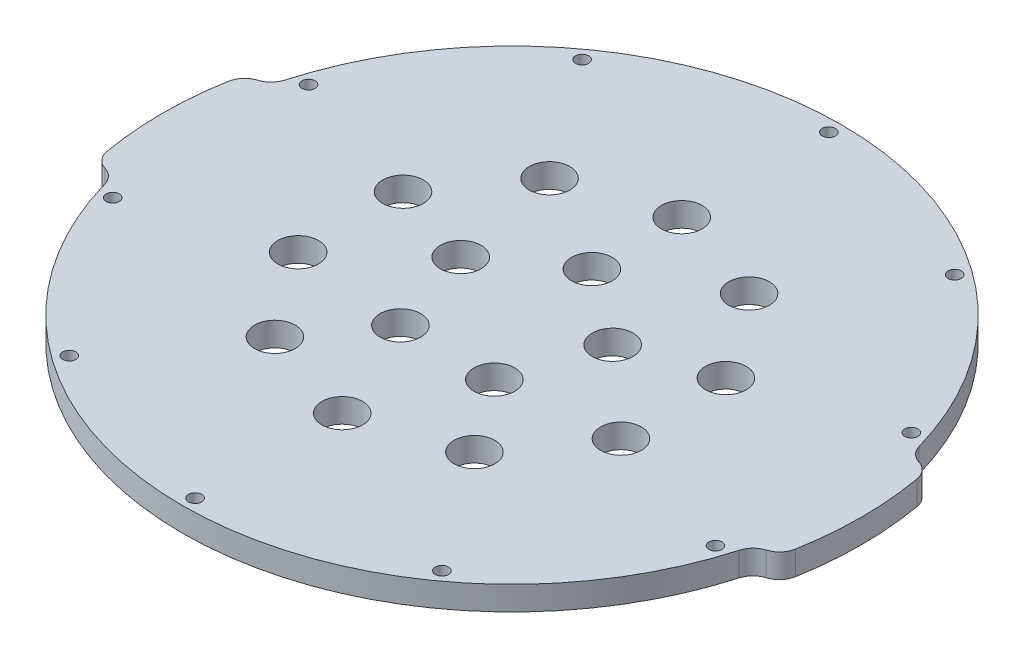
SolidWorks part; units mm, degrees
ref_plane "Front Plane" through (0, 0, 0) normal (0, 0, 1) x (1, 0, 0)
ref_plane "Top Plane" through (0, 0, 0) normal (0, 1, 0) x (1, 0, 0)
ref_plane "Right Plane" through (0, 0, 0) normal (1, 0, 0) x (0, 0, -1)
sketch "Sketch1" plane through (0, 0, 0) normal (0, 1, 0) x (1, 0, 0)
  line L0 (0, 0) -> (-86.2199, 15.2029) construction
  line L1 (0, 0) -> (-139.7786, 0) construction
  line L2 (0, 0) -> (-86.2199, -15.2029) construction
  line L3 (0, 0) -> (86.2199, 15.2029) construction
  line L4 (0, 0) -> (86.2199, -15.2029) construction
  circle A0 centre (0, 0) radius 79.35 construction
  circle A1 centre (0, 79.35) radius 1.65
  circle A2 centre (46.6408, 64.1955) radius 1.65
  circle A3 centre (75.4663, 24.5205) radius 1.65
  circle A4 centre (75.4663, -24.5205) radius 1.65
  circle A5 centre (46.6408, -64.1955) radius 1.65
  circle A6 centre (0, -79.35) radius 1.65
  circle A7 centre (-46.6408, -64.1955) radius 1.65
  circle A8 centre (-75.4663, -24.5205) radius 1.65
  circle A9 centre (-75.4663, 24.5205) radius 1.65
  circle A10 centre (-46.6408, 64.1955) radius 1.65
  circle A13 centre (0, 0) radius 82.55 construction
  circle A14 centre (0, 0) radius 87.55 construction
  arc A15 (-86.2199, -15.2029) -> (-86.2199, 15.2029) centre (0, 0) cw
  arc A16 (86.2199, -15.2029) -> (86.2199, 15.2029) centre (0, 0) ccw
  arc A17 (-86.2199, -15.2029) -> (-80.2789, -19.2301) centre (-81.2959, -14.3347) ccw
  arc A18 (-86.2199, 15.2029) -> (-80.2789, 19.2301) centre (-81.2959, 14.3347) cw
  arc A19 (86.2199, -15.2029) -> (80.2789, -19.2301) centre (81.2959, -14.3347) cw
  arc A20 (86.2199, 15.2029) -> (80.2789, 19.2301) centre (81.2959, 14.3347) ccw
  arc A21 (-80.2789, 19.2301) -> (80.2789, 19.2301) centre (0, 0) cw
  arc A22 (80.2789, -19.2301) -> (-80.2789, -19.2301) centre (0, 0) cw
  point P28 (0, 0)
  point P30 (0, 0)
  dimension "D1" = 3.3
  dimension "D2" = 158.7
  dimension "D4" = 165.1
  dimension "D5" = 5
  dimension "D6" = 10
extrude "Boss-Extrude1" add sketch "Sketch1" along normal blind 6
fillet "Fillet1" radius 5 4 edges at (80.2789, 3, 19.2301) (80.2789, 3, -19.2301) (-80.2789, 3, -19.2301) (-80.2789, 3, 19.2301)
sketch "Sketch2" plane through (0, 6, 0) normal (0, 1, 0) x (1, 0, 0)
  line L0 (0, 0) -> (0, -82.55) construction
  line L1 (0, 0) -> (11.7557, -16.1803) construction
  circle A0 centre (0, 42.5) radius 5.1
  circle A1 centre (0, 0) radius 42.5 construction
  circle A2 centre (24.9809, 34.3832) radius 5.1
  circle A3 centre (40.4199, 13.1332) radius 5.1
  circle A4 centre (40.4199, -13.1332) radius 5.1
  circle A5 centre (24.9809, -34.3832) radius 5.1
  arc A6 (-79.4157, -22.5311) -> (79.4157, -22.5311) centre (0, 0) ccw construction
  circle A7 centre (0, -42.5) radius 5.1
  circle A8 centre (-24.9809, -34.3832) radius 5.1
  circle A9 centre (-40.4199, -13.1332) radius 5.1
  circle A10 centre (-40.4199, 13.1332) radius 5.1
  circle A11 centre (-24.9809, 34.3832) radius 5.1
  circle A12 centre (0, 0) radius 20 construction
  circle A13 centre (11.7557, -16.1803) radius 5.1
  circle A14 centre (-11.7557, -16.1803) radius 5.1
  circle A15 centre (-19.0211, 6.1803) radius 5.1
  circle A16 centre (0, 20) radius 5.1
  circle A17 centre (19.0211, 6.1803) radius 5.1
  point P5 (0, -42.5)
  point P16 (0, 0)
  point P43 (0, 0)
  dimension "D1" = 10.2
  dimension "D3" = 5
  dimension "D4" = 85
  dimension "D5" = 20
  dimension "D6" = 36
  dimension "D2" = 10
extrude "Cut-Extrude1" cut sketch "Sketch2" against normal through all
